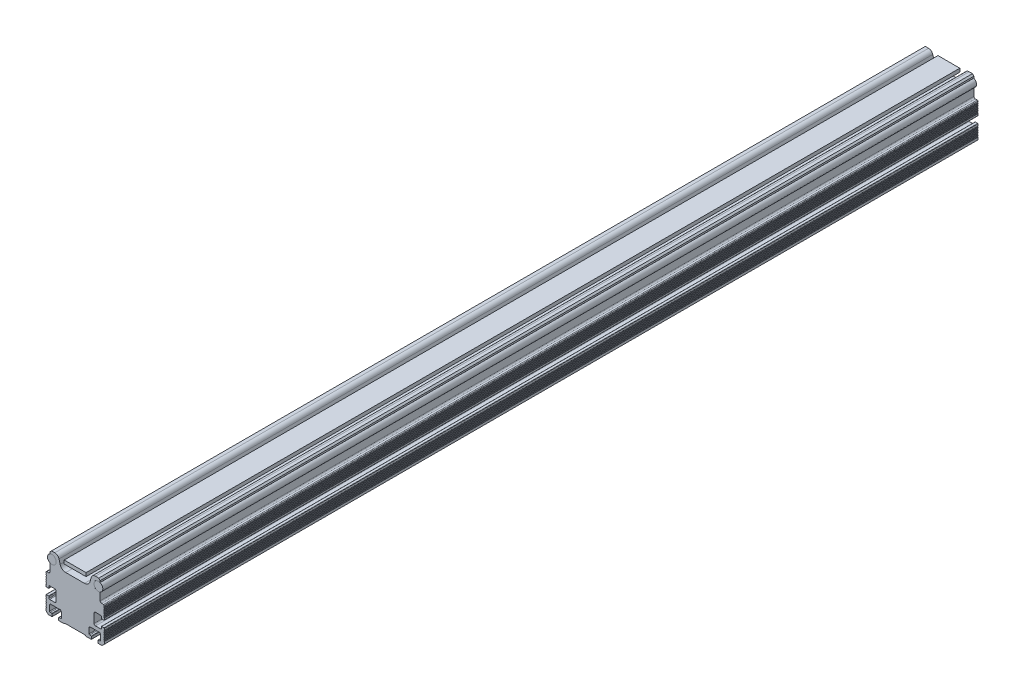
SolidWorks part; units mm, degrees
ref_plane "前视基准面" through (0, 0, 0) normal (0, 0, 1) x (1, 0, 0)
ref_plane "上视基准面" through (0, 0, 0) normal (0, 1, 0) x (1, 0, 0)
ref_plane "右视基准面" through (0, 0, 0) normal (1, 0, 0) x (0, 0, -1)
sketch "草图1" plane through (0, 0, 0) normal (0, 0, 1) x (1, 0, 0)
  line L0 (102.2464, 106.8787) -> (102.2464, 107.2079)
  line L1 (102.2464, 107.8787) -> (102.2464, 108.2079)
  line L2 (102.2464, 108.8787) -> (102.2464, 109.2079)
  line L3 (102.2464, 109.8787) -> (102.2464, 110.2079)
  line L4 (102.2464, 110.8787) -> (102.2464, 111.2079)
  line L5 (102.2464, 111.8787) -> (102.2464, 112.2079)
  line L6 (102.4464, 114.2933) -> (104.0464, 114.2933)
  line L7 (104.2464, 114.0933) -> (104.2464, 112.9933)
  line L8 (108.2464, 112.4933) -> (104.7464, 112.4933)
  line L9 (109.2464, 119.5933) -> (109.2464, 113.4933)
  line L10 (104.7464, 120.5933) -> (108.2464, 120.5933)
  line L11 (104.2464, 120.0933) -> (104.2464, 118.9933)
  line L12 (104.0464, 118.7933) -> (102.4464, 118.7933)
  line L13 (102.2464, 118.9933) -> (102.2464, 120.2079)
  line L14 (102.2464, 120.8787) -> (102.2464, 121.2079)
  line L15 (102.2464, 121.8787) -> (102.2464, 122.2079)
  line L16 (102.2464, 122.8787) -> (102.2464, 123.2079)
  line L17 (102.2464, 123.8787) -> (102.2464, 124.2079)
  line L18 (102.2464, 124.8787) -> (102.2464, 125.2079)
  line L19 (102.2464, 125.8787) -> (102.2464, 126.2079)
  line L20 (102.2464, 126.8787) -> (102.2464, 127.5433)
  line L21 (102.7464, 128.0433) -> (104.0464, 128.0433)
  line L22 (105.0464, 134.145) -> (105.0464, 129.0433)
  line L23 (105.0464, 141.0433) -> (105.0464, 139.9416)
  line L24 (105.0464, 141.0433) -> (106.0464, 142.0433)
  line L25 (108.3008, 142.0433) -> (106.0464, 142.0433)
  line L26 (111.952, 137.008) -> (111.1986, 139.8198)
  line L27 (128.6771, 134.0433) -> (115.8157, 134.0433)
  line L28 (133.2942, 139.8198) -> (132.5408, 137.008)
  line L29 (138.4464, 142.0433) -> (136.192, 142.0433)
  line L30 (138.4464, 142.0433) -> (139.4464, 141.0433)
  line L31 (139.4464, 129.0433) -> (139.4464, 134.145)
  line L32 (140.4464, 128.0433) -> (141.7464, 128.0433)
  line L33 (142.2464, 126.2079) -> (142.2464, 125.8787)
  line L34 (142.2464, 125.2079) -> (142.2464, 124.8787)
  line L35 (142.2464, 124.2079) -> (142.2464, 123.8787)
  line L36 (142.2464, 123.2079) -> (142.2464, 122.8787)
  line L37 (142.2464, 122.2079) -> (142.2464, 121.8787)
  line L38 (142.2464, 121.2079) -> (142.2464, 120.8787)
  line L39 (142.2464, 120.2079) -> (142.2464, 118.9933)
  line L40 (142.0464, 118.7933) -> (140.4464, 118.7933)
  line L41 (140.2464, 118.9933) -> (140.2464, 120.0933)
  line L42 (136.2464, 120.5933) -> (139.7464, 120.5933)
  line L43 (135.2464, 113.4933) -> (135.2464, 119.5933)
  line L44 (139.7464, 112.4933) -> (136.2464, 112.4933)
  line L45 (140.2464, 112.9933) -> (140.2464, 114.0933)
  line L46 (140.4464, 114.2933) -> (142.0464, 114.2933)
  line L47 (142.2464, 114.0933) -> (142.2464, 112.8787)
  line L48 (142.2464, 112.2079) -> (142.2464, 111.8787)
  line L49 (142.2464, 111.2079) -> (142.2464, 110.8787)
  line L50 (142.2464, 110.2079) -> (142.2464, 109.8787)
  line L51 (142.2464, 109.2079) -> (142.2464, 108.8787)
  line L52 (142.2464, 108.2079) -> (142.2464, 107.8787)
  line L53 (142.2464, 107.2079) -> (142.2464, 106.8787)
  line L54 (142.2464, 106.2079) -> (142.2464, 104.5433)
  line L55 (140.7464, 103.0433) -> (142.2464, 104.5433)
  line L56 (138.1964, 103.0433) -> (140.7464, 103.0433)
  line L57 (137.9964, 103.2433) -> (137.9964, 104.8433)
  line L58 (138.1964, 105.0433) -> (139.2964, 105.0433)
  line L59 (139.7964, 109.0433) -> (139.7964, 105.5433)
  line L60 (132.6964, 110.0433) -> (138.7964, 110.0433)
  line L61 (131.6964, 105.5433) -> (131.6964, 109.0433)
  line L62 (132.1964, 105.0433) -> (133.2964, 105.0433)
  line L63 (133.4964, 104.8433) -> (133.4964, 103.2433)
  line L64 (129.7464, 103.0433) -> (133.2964, 103.0433)
  line L65 (129.7464, 103.0433) -> (129.2464, 103.5433)
  line L66 (115.2464, 103.5433) -> (129.2464, 103.5433)
  line L67 (115.2464, 103.5433) -> (114.7464, 103.0433)
  line L68 (111.1964, 103.0433) -> (114.7464, 103.0433)
  line L69 (110.9964, 103.2433) -> (110.9964, 104.8433)
  line L70 (111.1964, 105.0433) -> (112.2964, 105.0433)
  line L71 (112.7964, 109.0433) -> (112.7964, 105.5433)
  line L72 (105.6964, 110.0433) -> (111.7964, 110.0433)
  line L73 (104.6964, 105.5433) -> (104.6964, 109.0433)
  line L74 (105.1964, 105.0433) -> (106.2964, 105.0433)
  line L75 (106.4964, 104.8433) -> (106.4964, 103.2433)
  line L76 (103.7464, 103.0433) -> (106.2964, 103.0433)
  line L77 (102.2464, 104.5433) -> (103.7464, 103.0433)
  line L78 (102.2464, 104.5433) -> (102.2464, 106.2079)
  line L79 (102.2464, 112.8787) -> (102.2464, 114.0933)
  line L80 (139.4464, 141.0433) -> (139.4464, 139.9416)
  line L81 (142.2464, 127.5433) -> (142.2464, 126.8787)
  line L95 (102.2464, 104.5433) -> (103.7464, 103.0433)
  line L97 (102.2464, 106.2079) -> (102.2464, 104.5433)
  line L108 (114.7464, 140.9433) -> (114.7464, 138.5433)
  line L109 (129.7464, 140.9433) -> (129.7464, 138.5433)
  line L110 (129.7464, 138.5433) -> (114.7464, 138.5433)
  line L111 (129.7464, 140.9433) -> (114.7464, 140.9433)
  arc A0 (102.3178, 106.3037) -> (102.3178, 106.7829) centre (102.2464, 106.5433) ccw
  arc A1 (102.2464, 106.8787) -> (102.3178, 106.7829) centre (102.3464, 106.8787) ccw
  arc A2 (102.3178, 107.3037) -> (102.2464, 107.2079) centre (102.3464, 107.2079) ccw
  arc A3 (102.3178, 107.3037) -> (102.3178, 107.7829) centre (102.2464, 107.5433) ccw
  arc A4 (102.2464, 107.8787) -> (102.3178, 107.7829) centre (102.3464, 107.8787) ccw
  arc A5 (102.3178, 108.3037) -> (102.2464, 108.2079) centre (102.3464, 108.2079) ccw
  arc A6 (102.3178, 108.3037) -> (102.3178, 108.7829) centre (102.2464, 108.5433) ccw
  arc A7 (102.2464, 108.8787) -> (102.3178, 108.7829) centre (102.3464, 108.8787) ccw
  arc A8 (102.3178, 109.3037) -> (102.2464, 109.2079) centre (102.3464, 109.2079) ccw
  arc A9 (102.3178, 109.3037) -> (102.3178, 109.7829) centre (102.2464, 109.5433) ccw
  arc A10 (102.2464, 109.8787) -> (102.3178, 109.7829) centre (102.3464, 109.8787) ccw
  arc A11 (102.3178, 110.3037) -> (102.2464, 110.2079) centre (102.3464, 110.2079) ccw
  arc A12 (102.3178, 110.3037) -> (102.3178, 110.7829) centre (102.2464, 110.5433) ccw
  arc A13 (102.2464, 110.8787) -> (102.3178, 110.7829) centre (102.3464, 110.8787) ccw
  arc A14 (102.3178, 111.3037) -> (102.2464, 111.2079) centre (102.3464, 111.2079) ccw
  arc A15 (102.3178, 111.3037) -> (102.3178, 111.7829) centre (102.2464, 111.5433) ccw
  arc A16 (102.2464, 111.8787) -> (102.3178, 111.7829) centre (102.3464, 111.8787) ccw
  arc A17 (102.3178, 112.3037) -> (102.2464, 112.2079) centre (102.3464, 112.2079) ccw
  arc A18 (102.3178, 112.3037) -> (102.3178, 112.7829) centre (102.2464, 112.5433) ccw
  arc A19 (102.2464, 112.8787) -> (102.3178, 112.7829) centre (102.3464, 112.8787) ccw
  arc A20 (102.4464, 114.2933) -> (102.2464, 114.0933) centre (102.4464, 114.0933) ccw
  arc A21 (104.2464, 114.0933) -> (104.0464, 114.2933) centre (104.0464, 114.0933) ccw
  arc A22 (104.2464, 112.9933) -> (104.7464, 112.4933) centre (104.7464, 112.9933) ccw
  arc A23 (108.2464, 112.4933) -> (109.2464, 113.4933) centre (108.2464, 113.4933) ccw
  arc A24 (109.2464, 119.5933) -> (108.2464, 120.5933) centre (108.2464, 119.5933) ccw
  arc A25 (104.7464, 120.5933) -> (104.2464, 120.0933) centre (104.7464, 120.0933) ccw
  arc A26 (104.0464, 118.7933) -> (104.2464, 118.9933) centre (104.0464, 118.9933) ccw
  arc A27 (102.2464, 118.9933) -> (102.4464, 118.7933) centre (102.4464, 118.9933) ccw
  arc A28 (102.3178, 120.3037) -> (102.2464, 120.2079) centre (102.3464, 120.2079) ccw
  arc A29 (102.3178, 120.3037) -> (102.3178, 120.7829) centre (102.2464, 120.5433) ccw
  arc A30 (102.2464, 120.8787) -> (102.3178, 120.7829) centre (102.3464, 120.8787) ccw
  arc A31 (102.3178, 121.3037) -> (102.2464, 121.2079) centre (102.3464, 121.2079) ccw
  arc A32 (102.3178, 121.3037) -> (102.3178, 121.7829) centre (102.2464, 121.5433) ccw
  arc A33 (102.2464, 121.8787) -> (102.3178, 121.7829) centre (102.3464, 121.8787) ccw
  arc A34 (102.3178, 122.3037) -> (102.2464, 122.2079) centre (102.3464, 122.2079) ccw
  arc A35 (102.3178, 122.3037) -> (102.3178, 122.7829) centre (102.2464, 122.5433) ccw
  arc A36 (102.2464, 122.8787) -> (102.3178, 122.7829) centre (102.3464, 122.8787) ccw
  arc A37 (102.3178, 123.3037) -> (102.2464, 123.2079) centre (102.3464, 123.2079) ccw
  arc A38 (102.3178, 123.3037) -> (102.3178, 123.7829) centre (102.2464, 123.5433) ccw
  arc A39 (102.2464, 123.8787) -> (102.3178, 123.7829) centre (102.3464, 123.8787) ccw
  arc A40 (102.3178, 124.3037) -> (102.2464, 124.2079) centre (102.3464, 124.2079) ccw
  arc A41 (102.3178, 124.3037) -> (102.3178, 124.7829) centre (102.2464, 124.5433) ccw
  arc A42 (102.2464, 124.8787) -> (102.3178, 124.7829) centre (102.3464, 124.8787) ccw
  arc A43 (102.3178, 125.3037) -> (102.2464, 125.2079) centre (102.3464, 125.2079) ccw
  arc A44 (102.3178, 125.3037) -> (102.3178, 125.7829) centre (102.2464, 125.5433) ccw
  arc A45 (102.2464, 125.8787) -> (102.3178, 125.7829) centre (102.3464, 125.8787) ccw
  arc A46 (102.3178, 126.3037) -> (102.2464, 126.2079) centre (102.3464, 126.2079) ccw
  arc A47 (102.3178, 126.3037) -> (102.3178, 126.7829) centre (102.2464, 126.5433) ccw
  arc A48 (102.2464, 126.8787) -> (102.3178, 126.7829) centre (102.3464, 126.8787) ccw
  arc A49 (102.7464, 128.0433) -> (102.2464, 127.5433) centre (102.7464, 127.5433) ccw
  arc A50 (104.0464, 128.0433) -> (105.0464, 129.0433) centre (104.0464, 129.0433) ccw
  arc A51 (105.1819, 134.2385) -> (105.0464, 134.145) centre (105.1464, 134.145) ccw
  arc A52 (105.1819, 134.2385) -> (108.2517, 134.8119) centre (106.2464, 137.0433) ccw
  arc A53 (108.2517, 134.8119) -> (108.5729, 135.1492) centre (108.3464, 135.0433) ccw
  arc A54 (108.5729, 135.1492) -> (108.5729, 138.9374) centre (106.2464, 137.0433) ccw
  arc A55 (108.5729, 138.9374) -> (108.2517, 139.2747) centre (108.3464, 139.0433) ccw
  arc A56 (108.2517, 139.2747) -> (105.1819, 139.8481) centre (106.2464, 137.0433) ccw
  arc A57 (105.0464, 139.9416) -> (105.1819, 139.8481) centre (105.1464, 139.9416) ccw
  arc A58 (111.1986, 139.8198) -> (108.3008, 142.0433) centre (108.3008, 139.0433) ccw
  arc A59 (111.952, 137.008) -> (115.8157, 134.0433) centre (115.8157, 138.0433) ccw
  arc A60 (128.6771, 134.0433) -> (132.5408, 137.008) centre (128.6771, 138.0433) ccw
  arc A61 (136.192, 142.0433) -> (133.2942, 139.8198) centre (136.192, 139.0433) ccw
  arc A62 (139.3109, 139.8481) -> (139.4464, 139.9416) centre (139.3464, 139.9416) ccw
  arc A63 (139.3109, 139.8481) -> (136.2411, 139.2747) centre (138.2464, 137.0433) ccw
  arc A64 (136.2411, 139.2747) -> (135.9199, 138.9374) centre (136.1464, 139.0433) ccw
  arc A65 (135.9199, 138.9374) -> (135.9199, 135.1492) centre (138.2464, 137.0433) ccw
  arc A66 (135.9199, 135.1492) -> (136.2411, 134.8119) centre (136.1464, 135.0433) ccw
  arc A67 (136.2411, 134.8119) -> (139.3109, 134.2385) centre (138.2464, 137.0433) ccw
  arc A68 (139.4464, 134.145) -> (139.3109, 134.2385) centre (139.3464, 134.145) ccw
  arc A69 (139.4464, 129.0433) -> (140.4464, 128.0433) centre (140.4464, 129.0433) ccw
  arc A70 (142.2464, 127.5433) -> (141.7464, 128.0433) centre (141.7464, 127.5433) ccw
  arc A71 (142.175, 126.7829) -> (142.175, 126.3037) centre (142.2464, 126.5433) ccw
  arc A72 (142.2464, 126.2079) -> (142.175, 126.3037) centre (142.1464, 126.2079) ccw
  arc A73 (142.175, 125.7829) -> (142.2464, 125.8787) centre (142.1464, 125.8787) ccw
  arc A74 (142.175, 125.7829) -> (142.175, 125.3037) centre (142.2464, 125.5433) ccw
  arc A75 (142.2464, 125.2079) -> (142.175, 125.3037) centre (142.1464, 125.2079) ccw
  arc A76 (142.175, 124.7829) -> (142.2464, 124.8787) centre (142.1464, 124.8787) ccw
  arc A77 (142.175, 124.7829) -> (142.175, 124.3037) centre (142.2464, 124.5433) ccw
  arc A78 (142.2464, 124.2079) -> (142.175, 124.3037) centre (142.1464, 124.2079) ccw
  arc A79 (142.175, 123.7829) -> (142.2464, 123.8787) centre (142.1464, 123.8787) ccw
  arc A80 (142.175, 123.7829) -> (142.175, 123.3037) centre (142.2464, 123.5433) ccw
  arc A81 (142.2464, 123.2079) -> (142.175, 123.3037) centre (142.1464, 123.2079) ccw
  arc A82 (142.175, 122.7829) -> (142.2464, 122.8787) centre (142.1464, 122.8787) ccw
  arc A83 (142.175, 122.7829) -> (142.175, 122.3037) centre (142.2464, 122.5433) ccw
  arc A84 (142.2464, 122.2079) -> (142.175, 122.3037) centre (142.1464, 122.2079) ccw
  arc A85 (142.175, 121.7829) -> (142.2464, 121.8787) centre (142.1464, 121.8787) ccw
  arc A86 (142.175, 121.7829) -> (142.175, 121.3037) centre (142.2464, 121.5433) ccw
  arc A87 (142.2464, 121.2079) -> (142.175, 121.3037) centre (142.1464, 121.2079) ccw
  arc A88 (142.175, 120.7829) -> (142.2464, 120.8787) centre (142.1464, 120.8787) ccw
  arc A89 (142.175, 120.7829) -> (142.175, 120.3037) centre (142.2464, 120.5433) ccw
  arc A90 (142.2464, 120.2079) -> (142.175, 120.3037) centre (142.1464, 120.2079) ccw
  arc A91 (142.0464, 118.7933) -> (142.2464, 118.9933) centre (142.0464, 118.9933) ccw
  arc A92 (140.2464, 118.9933) -> (140.4464, 118.7933) centre (140.4464, 118.9933) ccw
  arc A93 (140.2464, 120.0933) -> (139.7464, 120.5933) centre (139.7464, 120.0933) ccw
  arc A94 (136.2464, 120.5933) -> (135.2464, 119.5933) centre (136.2464, 119.5933) ccw
  arc A95 (135.2464, 113.4933) -> (136.2464, 112.4933) centre (136.2464, 113.4933) ccw
  arc A96 (142.2464, 114.0933) -> (142.0464, 114.2933) centre (142.0464, 114.0933) ccw
  arc A97 (142.175, 112.7829) -> (142.2464, 112.8787) centre (142.1464, 112.8787) ccw
  arc A98 (142.175, 112.7829) -> (142.175, 112.3037) centre (142.2464, 112.5433) ccw
  arc A99 (142.2464, 112.2079) -> (142.175, 112.3037) centre (142.1464, 112.2079) ccw
  arc A100 (142.175, 111.7829) -> (142.2464, 111.8787) centre (142.1464, 111.8787) ccw
  arc A101 (142.175, 111.7829) -> (142.175, 111.3037) centre (142.2464, 111.5433) ccw
  arc A102 (142.2464, 111.2079) -> (142.175, 111.3037) centre (142.1464, 111.2079) ccw
  arc A103 (142.175, 110.7829) -> (142.2464, 110.8787) centre (142.1464, 110.8787) ccw
  arc A104 (142.175, 110.7829) -> (142.175, 110.3037) centre (142.2464, 110.5433) ccw
  arc A105 (142.2464, 110.2079) -> (142.175, 110.3037) centre (142.1464, 110.2079) ccw
  arc A106 (142.175, 109.7829) -> (142.2464, 109.8787) centre (142.1464, 109.8787) ccw
  arc A107 (142.175, 109.7829) -> (142.175, 109.3037) centre (142.2464, 109.5433) ccw
  arc A108 (142.2464, 109.2079) -> (142.175, 109.3037) centre (142.1464, 109.2079) ccw
  arc A109 (142.175, 108.7829) -> (142.2464, 108.8787) centre (142.1464, 108.8787) ccw
  arc A110 (142.175, 108.7829) -> (142.175, 108.3037) centre (142.2464, 108.5433) ccw
  arc A111 (142.2464, 108.2079) -> (142.175, 108.3037) centre (142.1464, 108.2079) ccw
  arc A112 (142.175, 107.7829) -> (142.2464, 107.8787) centre (142.1464, 107.8787) ccw
  arc A113 (142.175, 107.7829) -> (142.175, 107.3037) centre (142.2464, 107.5433) ccw
  arc A114 (142.2464, 107.2079) -> (142.175, 107.3037) centre (142.1464, 107.2079) ccw
  arc A115 (142.175, 106.7829) -> (142.2464, 106.8787) centre (142.1464, 106.8787) ccw
  arc A116 (142.175, 106.7829) -> (142.175, 106.3037) centre (142.2464, 106.5433) ccw
  arc A117 (142.2464, 106.2079) -> (142.175, 106.3037) centre (142.1464, 106.2079) ccw
  arc A118 (137.9964, 103.2433) -> (138.1964, 103.0433) centre (138.1964, 103.2433) ccw
  arc A119 (138.1964, 105.0433) -> (137.9964, 104.8433) centre (138.1964, 104.8433) ccw
  arc A120 (139.2964, 105.0433) -> (139.7964, 105.5433) centre (139.2964, 105.5433) ccw
  arc A121 (139.7964, 109.0433) -> (138.7964, 110.0433) centre (138.7964, 109.0433) ccw
  arc A122 (132.6964, 110.0433) -> (131.6964, 109.0433) centre (132.6964, 109.0433) ccw
  arc A123 (131.6964, 105.5433) -> (132.1964, 105.0433) centre (132.1964, 105.5433) ccw
  arc A124 (133.4964, 104.8433) -> (133.2964, 105.0433) centre (133.2964, 104.8433) ccw
  arc A125 (133.2964, 103.0433) -> (133.4964, 103.2433) centre (133.2964, 103.2433) ccw
  arc A126 (110.9964, 103.2433) -> (111.1964, 103.0433) centre (111.1964, 103.2433) ccw
  arc A127 (111.1964, 105.0433) -> (110.9964, 104.8433) centre (111.1964, 104.8433) ccw
  arc A128 (112.2964, 105.0433) -> (112.7964, 105.5433) centre (112.2964, 105.5433) ccw
  arc A129 (112.7964, 109.0433) -> (111.7964, 110.0433) centre (111.7964, 109.0433) ccw
  arc A130 (105.6964, 110.0433) -> (104.6964, 109.0433) centre (105.6964, 109.0433) ccw
  arc A131 (104.6964, 105.5433) -> (105.1964, 105.0433) centre (105.1964, 105.5433) ccw
  arc A132 (106.4964, 104.8433) -> (106.2964, 105.0433) centre (106.2964, 104.8433) ccw
  arc A133 (106.2964, 103.0433) -> (106.4964, 103.2433) centre (106.2964, 103.2433) ccw
  arc A134 (102.3178, 106.3037) -> (102.2464, 106.2079) centre (102.3464, 106.2079) ccw
  arc A135 (140.4464, 114.2933) -> (140.2464, 114.0933) centre (140.4464, 114.0933) ccw
  arc A136 (142.175, 126.7829) -> (142.2464, 126.8787) centre (142.1464, 126.8787) ccw
  arc A137 (139.7464, 112.4933) -> (140.2464, 112.9933) centre (139.7464, 112.9933) ccw
extrude "凸台-拉伸1" add sketch "草图1" along normal blind 600 contours A137 L44 A95 L43 A94 L42 A93 L41 A92 L40 A91 L39 A90 A89 A88 L38 A87 A86 A85 L37 A84 A83 A82 L36 A81 A80 A79 L35 A78 A77 A76 L34 A75 A74 A73 L33 A72 A71 A136 L81 A70 L32 A69 L31 A68 A67 A66 A65 A64 A63 A62 | L110 L108 L111 L109
sketch "草图2" plane through (0, 0, 600) normal (0, 0, 1) x (1, 0, 0)
  circle A0 centre (106.2464, 137.0433) radius 3
  circle A1 centre (138.2464, 137.0433) radius 3
  arc A2 (139.3109, 139.8481) -> (136.2411, 139.2747) centre (138.2464, 137.0433) ccw construction
  arc A3 (108.2517, 139.2747) -> (105.1819, 139.8481) centre (106.2464, 137.0433) ccw construction
extrude "凸台-拉伸2" add sketch "草图2" against normal up to surface (600 mm away) separate body
